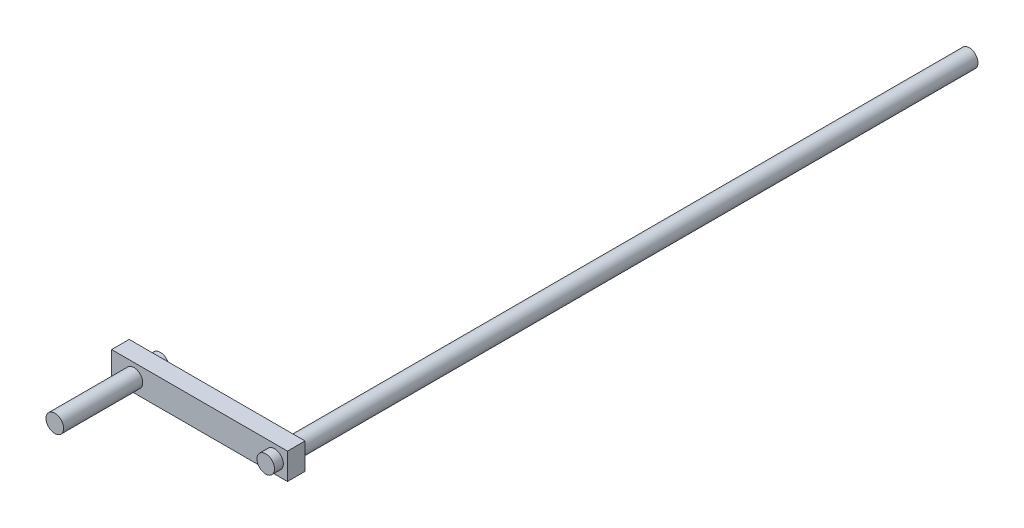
SolidWorks part; units mm, degrees
ref_plane "Front Plane" through (0, 0, 0) normal (0, 0, 1) x (1, 0, 0)
ref_plane "Top Plane" through (0, 0, 0) normal (0, 1, 0) x (1, 0, 0)
ref_plane "Right Plane" through (0, 0, 0) normal (1, 0, 0) x (0, 0, -1)
sketch "Sketch1" plane through (0, 0, 0) normal (0, 0, 1) x (1, 0, 0)
  circle A0 centre (0, 0) radius 1
  dimension "D1" = 2
extrude "Extrude1" add sketch "Sketch1" along normal blind 80
sketch "Sketch2" plane through (0, 0, 80) normal (0, 0, 1) x (1, 0, 0)
  line L0 (1.4712, 0) -> (0, 0) construction
  line L1 (-18.5288, 1.5) -> (1.4712, 1.5)
  line L2 (-18.5288, 1.5) -> (-18.5288, -1.5)
  line L3 (-18.5288, -1.5) -> (1.4712, -1.5)
  line L4 (1.4712, 1.5) -> (1.4712, -1.5)
  dimension "D1" = 3
  dimension "D2" = 20
extrude "Extrude2" add sketch "Sketch2" against normal blind 2 from offset 1
sketch "Sketch3" plane through (0, 0, 77) normal (0, 0, -1) x (-1, 0, 0)
  line L0 (18.5288, 0) -> (15.9889, 0) construction
  line L1 (18.5288, 1.5) -> (18.5288, -1.5) construction
  circle A0 centre (15.9889, 0) radius 1
  circle A1 centre (0, 0) radius 1 construction
extrude "Extrude3" add sketch "Sketch3" against normal blind 12 from offset 1
